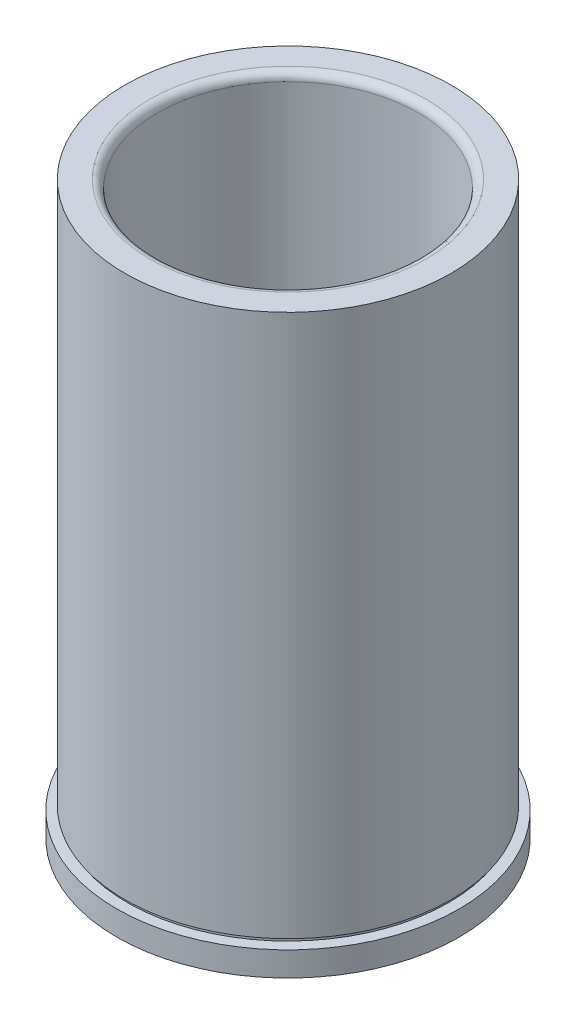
SolidWorks part; units mm, degrees
ref_plane "Front Plane" through (0, 0, 0) normal (0, 0, 1) x (1, 0, 0)
ref_plane "Top Plane" through (0, 0, 0) normal (0, 1, 0) x (1, 0, 0)
ref_plane "Right Plane" through (0, 0, 0) normal (1, 0, 0) x (0, 0, -1)
sketch "Sketch1" plane through (0, 0, 0) normal (0, 0, 1) x (1, 0, 0)
  line L0 (-911.3132, 0) -> (49088.6868, 0) construction
  line L1 (0, -1000) -> (0, 49000) construction
  line L2 (-25.4063, 111.125) -> (-25.4063, 9.525)
  line L4 (-33.3375, 0) -> (-33.3375, 4.7625)
  line L5 (-33.3375, 4.7625) -> (-31.2483, 4.7625)
  line L6 (-31.7564, 111.125) -> (-31.7563, 5.5245)
  line L7 (-31.7564, 111.125) -> (-25.4063, 111.125)
  line L9 (-26.6763, 8.255) -> (-26.6763, 0.7938)
  line L10 (-31.7563, 5.5245) -> (-31.2483, 5.5245)
  line L11 (-31.2483, 5.5245) -> (-31.2483, 4.7625)
  line L12 (-26.6763, 0.7938) -> (-27.4701, 0)
  line L13 (-27.4701, 0) -> (-33.3375, 0)
  arc A0 (-25.4063, 9.525) -> (-26.6763, 8.255) centre (-25.4063, 8.255) ccw
  dimension "D1" = 0.508
  dimension "OD" = 63.5127
  dimension "ID" = 50.8127
  dimension "FLANGETHICKNESS" = 4.7625
  dimension "FLANGEDIA" = 66.675
  dimension "D2" = 111.125
  dimension "D3" = 0.762
  dimension "D4" = 1.27
  dimension "D5" = 45
  dimension "D6" = 101.6
  dimension "D7" = 0.7937
revolve "Revolve1" add sketch "Sketch1" angle 360 about L1
fillet "Fillet1" radius 1.524 1 edges at (25.4063, 111.125, 0)
